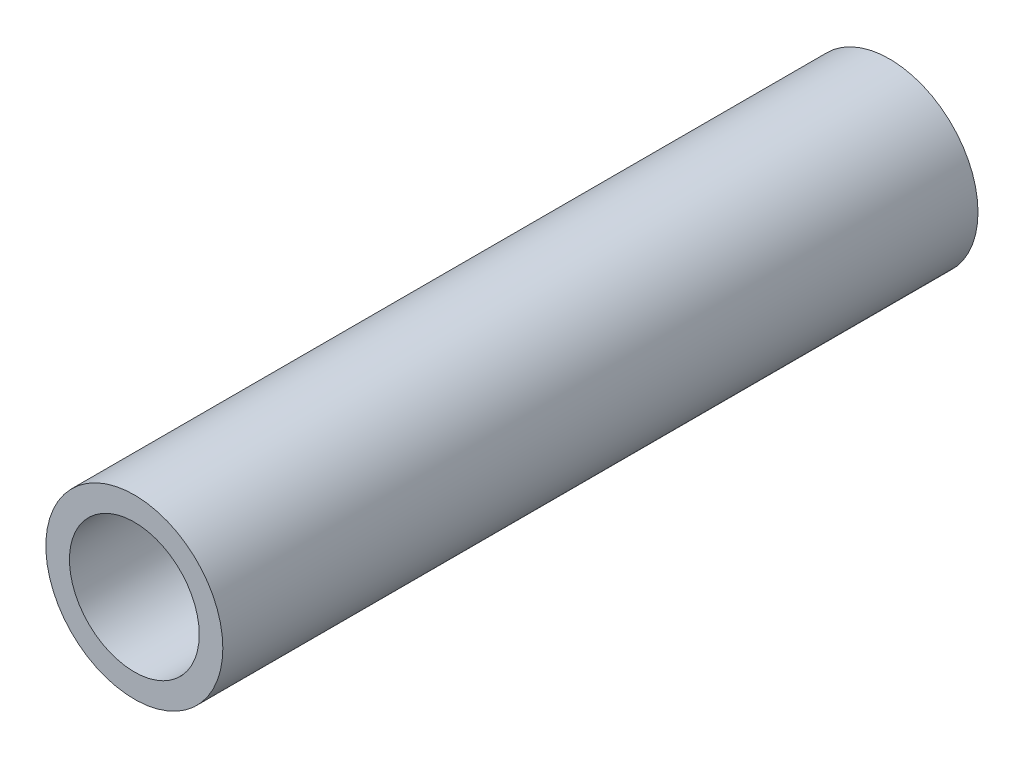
SolidWorks part; units mm, degrees
ref_plane "Frontal" through (0, 0, 0) normal (0, 0, 1) x (1, 0, 0)
ref_plane "Horizontal" through (0, 0, 0) normal (0, 1, 0) x (1, 0, 0)
ref_plane "Profil" through (0, 0, 0) normal (1, 0, 0) x (0, 0, -1)
sketch "Esquisse1" plane through (0, 0, 0) normal (0, 0, 1) x (1, 0, 0)
  circle A0 centre (0, 0) radius 7.5
  circle A1 centre (0, 0) radius 5.5
  dimension "D1" = 11
  dimension "D2" = 15
extrude "Base-Extrusion" add sketch "Esquisse1" along normal blind 64
